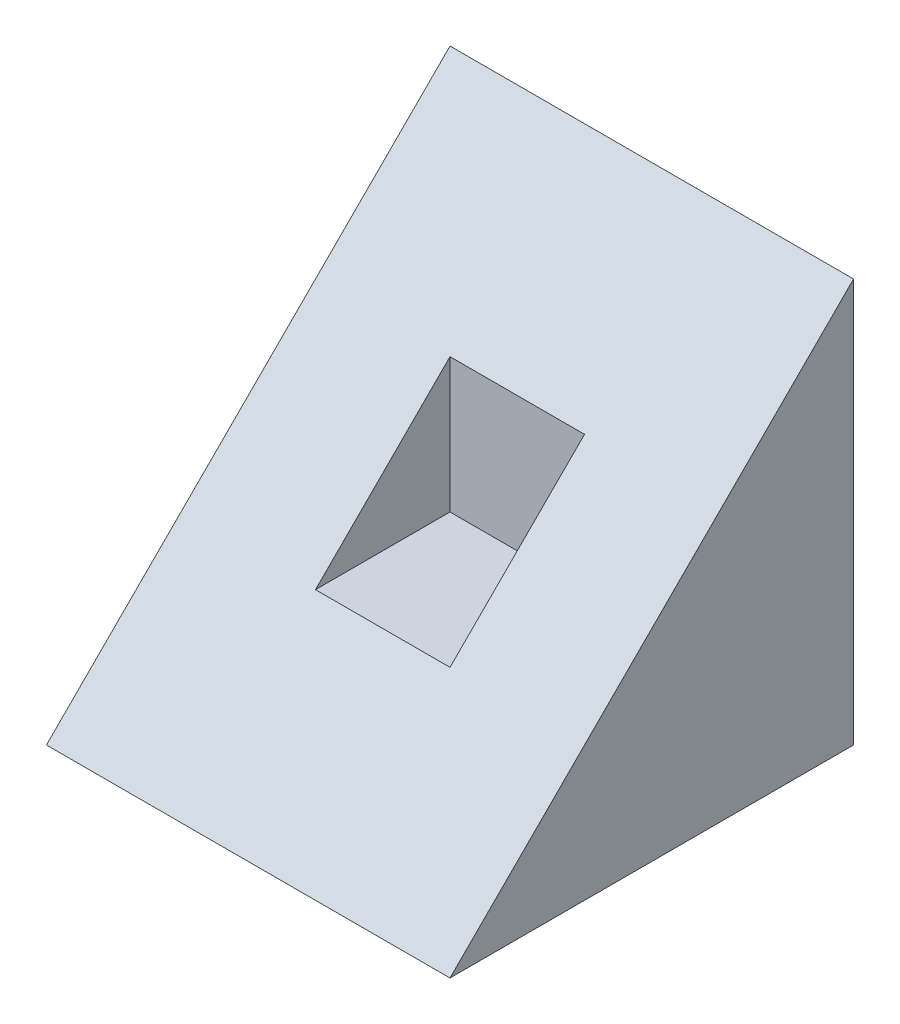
SolidWorks part; units mm, degrees
ref_plane "Front Plane" through (0, 0, 0) normal (0, 0, 1) x (1, 0, 0)
ref_plane "Top Plane" through (0, 0, 0) normal (0, 1, 0) x (1, 0, 0)
ref_plane "Right Plane" through (0, 0, 0) normal (1, 0, 0) x (0, 0, -1)
sketch "Sketch2" plane through (0, 0, 0) normal (1, 0, 0) x (0, 0, -1)
  line L0 (76.2, 76.2) -> (-76.2, -76.2)
  line L1 (76.2, 76.2) -> (76.2, -76.2)
  line L2 (76.2, -76.2) -> (-76.2, -76.2)
  dimension "D1" = 45
  dimension "D2" = 152.4
extrude "Boss-Extrude1" add sketch "Sketch2" along normal mid plane 152.4 contours L0 L2 L1
sketch "Sketch3" plane through (0, 0, 0) normal (0, 1, 0) x (1, 0, 0)
  line L1 (25.4, 25.4) -> (-25.4, 25.4)
  line L2 (25.4, 25.4) -> (25.4, -25.4)
  line L3 (25.4, -25.4) -> (-25.4, -25.4)
  line L4 (-25.4, 25.4) -> (-25.4, -25.4)
  line L5 (25.4, 25.4) -> (-25.4, -25.4) construction
  line L6 (25.4, -25.4) -> (-25.4, 25.4) construction
  point P0 (0, 0)
  dimension "D1" = 50.8
extrude "Cut-Extrude1" cut sketch "Sketch3" against normal mid plane 50.8
